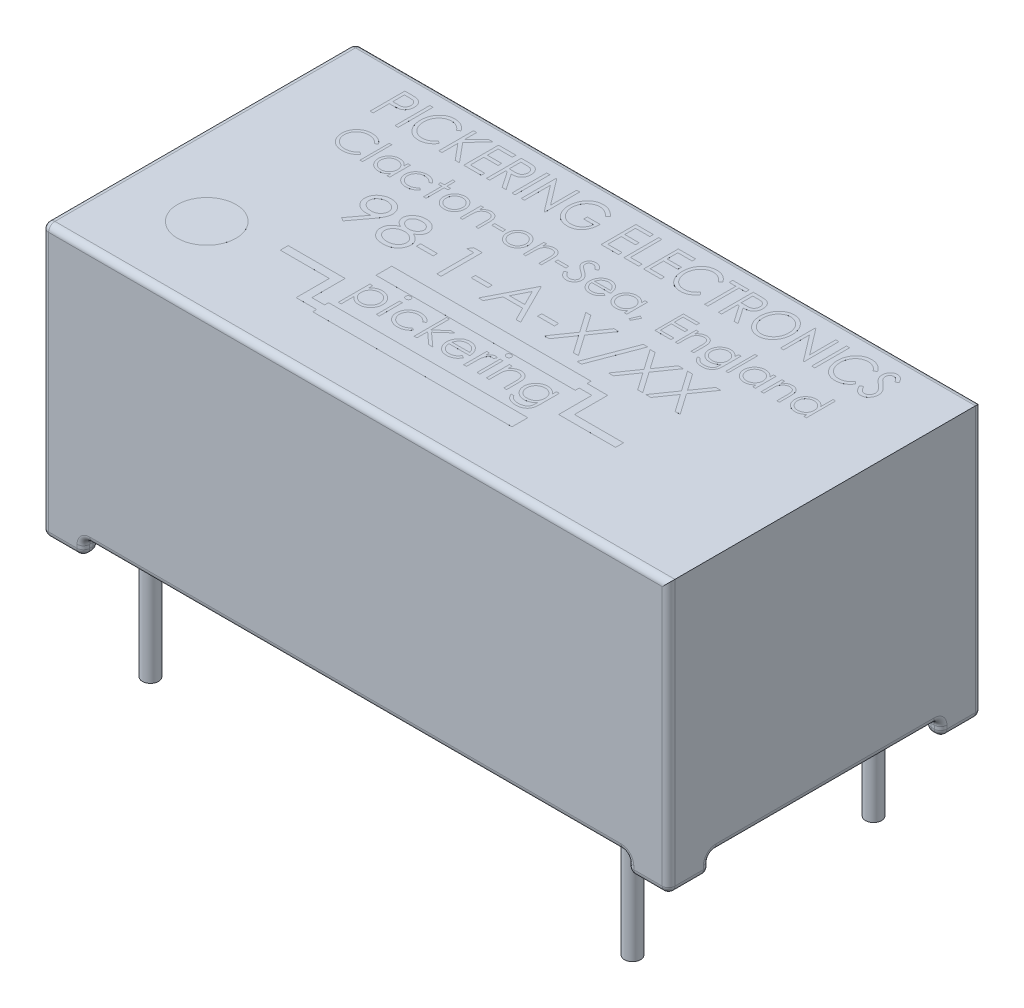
SolidWorks part; units mm, degrees
ref_plane "Front Plane" through (0, 0, 0) normal (0, 0, 1) x (1, 0, 0)
ref_plane "Top Plane" through (0, 0, 0) normal (0, 1, 0) x (1, 0, 0)
ref_plane "Right Plane" through (0, 0, 0) normal (1, 0, 0) x (0, 0, -1)
sketch "Sketch1" plane through (0, 0, 0) normal (0, 1, 0) x (1, 0, 0)
  line L1 (9.9, -4.95) -> (-9.9, -4.95)
  line L2 (9.9, -4.95) -> (9.9, 4.95)
  line L3 (9.9, 4.95) -> (-9.9, 4.95)
  line L4 (-9.9, -4.95) -> (-9.9, 4.95)
  line L5 (9.9, -4.95) -> (-9.9, 4.95) construction
  line L6 (9.9, 4.95) -> (-9.9, -4.95) construction
  point P0 (0, 0)
  dimension "D1" = 9.9
  dimension "D2" = 19.8
extrude "Main Body" add sketch "Sketch1" along normal blind 8.092
sketch "Sketch2" plane through (0, 0, 0) normal (0, -1, 0) x (1, 0, 0)
  line L1 (-9.9, 4.95) -> (-8.6, 4.95)
  line L2 (-9.9, 4.95) -> (-9.9, 3.65)
  line L3 (-9.9, 3.65) -> (-9.4, 3.65)
  line L4 (-8.6, 4.95) -> (-8.6, 4.45)
  line L7 (-8.6, 4.45) -> (-9.4, 4.45)
  line L8 (-9.4, 3.65) -> (-9.4, 4.45)
  dimension "D1" = 1.3
  dimension "D2" = 1.3
  dimension "D3" = 0.5
  dimension "D4" = 0.5
extrude "Foot" add sketch "Sketch2" along normal blind 0.508
mirror "Mirror1" about plane through (0, 0, 0) normal (0, 0, 1) of "Foot"
mirror "Mirror2" about plane through (0, 0, 0) normal (1, 0, 0) of "Mirror1", "Foot"
sketch "Sketch3"
  dimension "D1" = 11.5
  dimension "D2" = 4.15
  dimension "D3" = 1.7
  dimension "D4" = 1.5
  dimension "D5" = 1.9
extrude "Lettering" add sketch "Sketch3" along normal blind 0.0001
sketch "Sketch4"
  dimension "D7" = 1.85
  dimension "D1" = 0.5
  dimension "D2" = 6.3
  dimension "D3" = 6.75
  dimension "D4" = 0.5
  dimension "D5" = 1.5
  dimension "D6" = 1.8
  dimension "D8" = 2.6
  dimension "D9" = 2.6
  dimension "D10" = 0.65
  dimension "D11" = 0.25
  dimension "D12" = 0.25
  dimension "D13" = 1.3
  dimension "D14" = 0.25
  dimension "D15" = 1.8
  dimension "D16" = 0.125
  dimension "D17" = 0.65
  dimension "D18" = 0.125
  dimension "D19" = 0.25
  dimension "D20" = 0.25
  dimension "D21" = 1.3
  dimension "D22" = 0.25
  dimension "D23" = 1.8
extrude "Pickering logo" add sketch "Sketch4" along normal blind 0.0001
sketch "Sketch5" plane through (0, 0, 0) normal (0, -1, 0) x (1, 0, 0)
  line L0 (-8.6, 4.95) -> (8.6, 4.95) construction
  line L2 (-9.9, -3.65) -> (-9.9, 3.65) construction
  circle A0 centre (-7.62, 3.81) radius 0.254
  circle A1 centre (-7.62, -3.81) radius 0.254
  circle A2 centre (-5.08, -3.81) radius 0.254
  dimension "D1" = 0.508
  dimension "D2" = 1.14
  dimension "D3" = 2.28
  dimension "D4" = 2.54
extrude "Pins Left" add sketch "Sketch5" along normal blind 3.808
mirror "Pins Right" about plane through (0, 0, 0) normal (1, 0, 0) of "Pins Left"
fillet "Fillet1" radius 0.2 67 edges at (-9.4, 0, -4.05) (-9, 0, -4.45) (-9, 0, 4.45) (9, 0, 4.45) (9, 0, -4.45) (9.4, 0, -4.05) (9.4, 0, 4.05) (-9.4, 0, 4.05) (-9.4, -0.508, -4.05) (-9, -0.508, -4.45) (-9.9, -0.508, -4.3) (-9.4, -0.254, -3.65) (-9.65, -0.508, -3.65) (-9.9, -0.254, -3.65) (-9.65, 0, -3.65) (-8.6, -0.508, -4.7) (-8.6, -0.254, -4.45) (-8.6, 0, -4.7) (-8.6, -0.254, 4.45) (8.6, -0.254, 4.45) (8.6, 0, 4.7) (8.6, -0.254, -4.45) (8.6, 0, -4.7) (9.4, -0.254, -3.65) (9.9, -0.254, -3.65) (9.65, 0, -3.65) (9.4, -0.254, 3.65) (9.9, -0.254, 3.65) (9.65, 0, 3.65) (9.65, -0.508, 3.65) (9.4, -0.508, 4.05) (9, -0.508, 4.45) (8.6, -0.508, 4.7) (9.9, -0.508, 4.3) (8.6, -0.508, -4.7) (9, -0.508, -4.45) (9.4, -0.508, -4.05) (9.65, -0.508, -3.65) (9.9, -0.508, -4.3) (-9.4, -0.254, 3.65) (-8.6, -0.508, 4.7) (-9, -0.508, 4.45) (-9.4, -0.508, 4.05) (-9.65, -0.508, 3.65) (-9.9, -0.508, 4.3) (0, 8.092, -4.95) (-9.9, 3.792, -4.95) (-9.25, -0.508, -4.95) (-8.6, -0.254, -4.95) (0, 0, -4.95) (8.6, -0.254, -4.95) (9.25, -0.508, -4.95) (9.9, 3.792, -4.95) (0, 8.092, 4.95) (9.9, 3.792, 4.95) (9.25, -0.508, 4.95) (8.6, -0.254, 4.95) (-9.25, -0.508, 4.95) (-9.9, 3.792, 4.95) (9.9, 0, 0) (-9.9, 8.092, 0)
